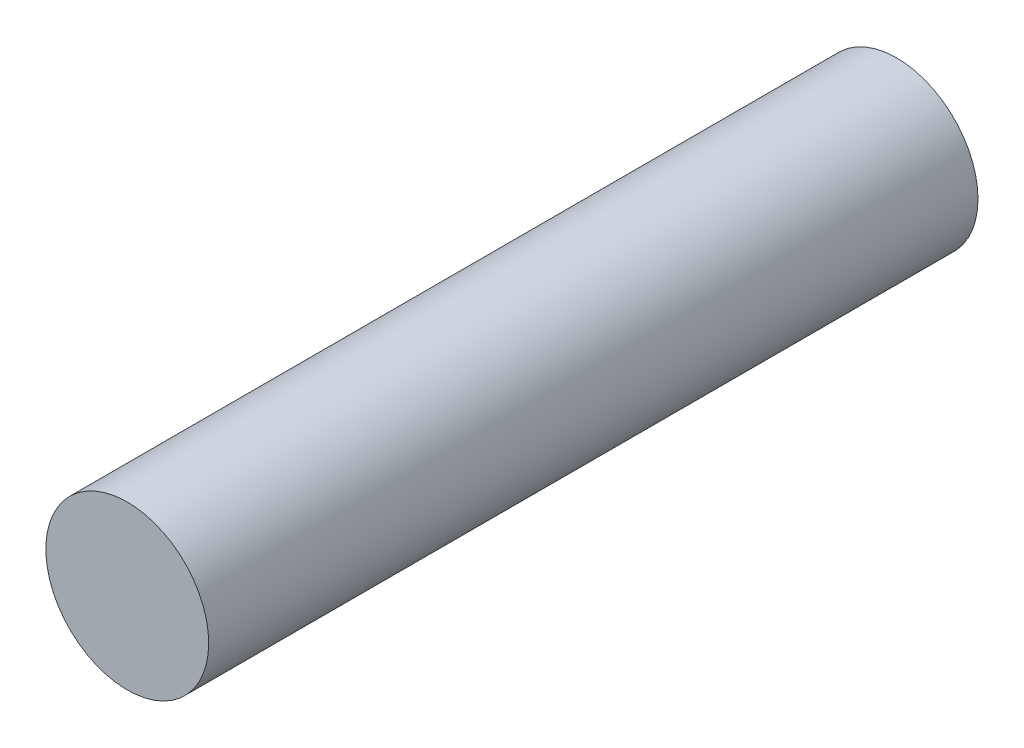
SolidWorks part; units mm, degrees
ref_plane "Спереди" through (0, 0, 0) normal (0, 0, 1) x (1, 0, 0)
ref_plane "Сверху" through (0, 0, 0) normal (0, 1, 0) x (1, 0, 0)
ref_plane "Справа" through (0, 0, 0) normal (1, 0, 0) x (0, 0, -1)
sketch "Эскиз1" plane through (0, 0, 0) normal (0, 0, 1) x (1, 0, 0)
  circle A0 centre (0, 0) radius 3.175
  dimension "D1" = 6.35
extrude "Бобышка-Вытянуть1" add sketch "Эскиз1" along normal blind 30
